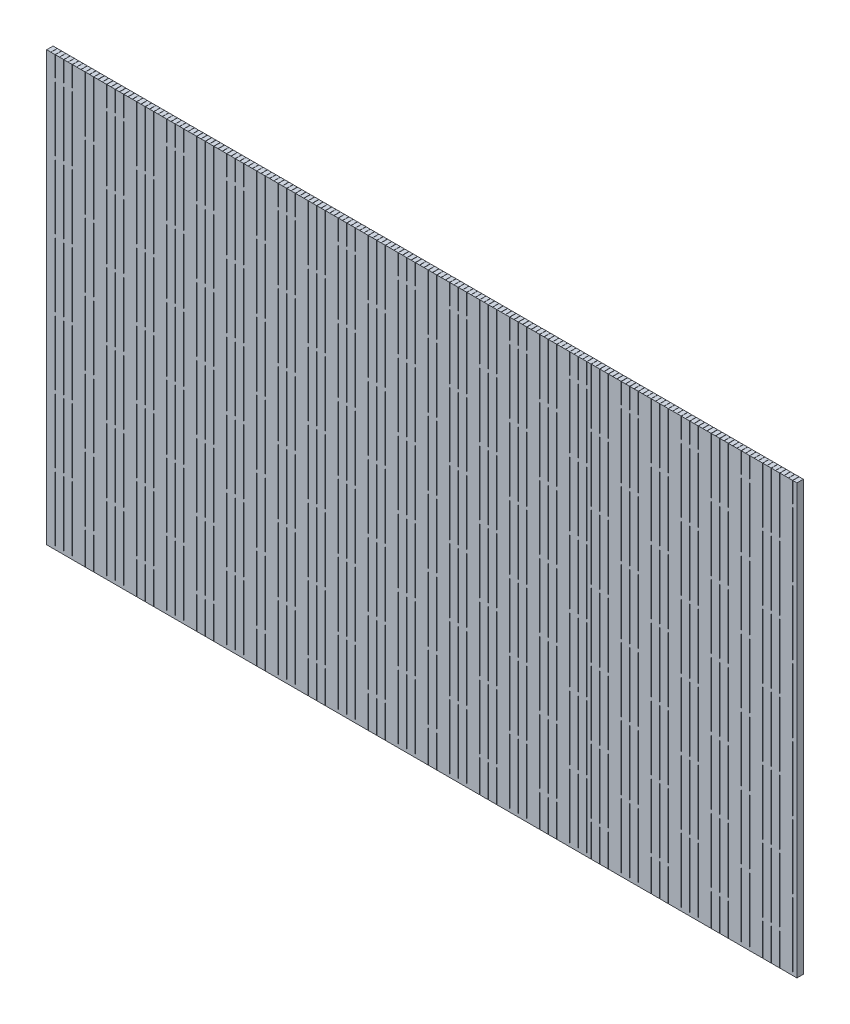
SolidWorks part; units mm, degrees
ref_plane "Front Plane" through (0, 0, 0) normal (0, 0, 1) x (1, 0, 0)
ref_plane "Top Plane" through (0, 0, 0) normal (0, 1, 0) x (1, 0, 0)
ref_plane "Right Plane" through (0, 0, 0) normal (1, 0, 0) x (0, 0, -1)
sketch "Sketch1" plane through (0, 0, 0) normal (0, 0, 1) x (1, 0, 0)
  line L1 (0, 0) -> (-350, 0)
  line L2 (0, 0) -> (0, 200)
  line L3 (0, 200) -> (-350, 200)
  line L4 (-350, 0) -> (-350, 200)
extrude "Boss-Extrude1" add sketch "Sketch1" along normal blind 3
sketch "Sketch3" plane through (0, 0, 0) normal (0, 0, -1) x (-1, 0, 0)
  line L0 (2, 1.5) -> (2, 31.5)
  line L1 (0, 0) -> (0, 200) construction
  line L2 (350, 0) -> (0, 0) construction
  line L3 (4, 15) -> (4, -15)
  line L4 (6, 1.5) -> (6, 31.5)
  line L5 (8, 15) -> (8, -15)
  line L6 (10, 1.5) -> (10, 31.5)
  line L7 (12, 15) -> (12, -15)
  line L8 (14, 1.5) -> (14, 31.5)
  line L9 (16, 15) -> (16, -15)
  line L10 (18, 1.5) -> (18, 31.5)
  line L11 (20, 15) -> (20, -15)
  line L12 (22, 1.5) -> (22, 31.5)
  line L13 (24, 15) -> (24, -15)
  line L14 (26, 1.5) -> (26, 31.5)
  line L15 (28, 15) -> (28, -15)
  line L16 (30, 1.5) -> (30, 31.5)
  line L17 (32, 15) -> (32, -15)
  line L18 (34, 1.5) -> (34, 31.5)
  line L19 (36, 15) -> (36, -15)
  line L20 (38, 1.5) -> (38, 31.5)
  line L21 (40, 15) -> (40, -15)
  line L22 (42, 1.5) -> (42, 31.5)
  line L23 (44, 15) -> (44, -15)
  line L24 (46, 1.5) -> (46, 31.5)
  line L25 (48, 15) -> (48, -15)
  line L26 (50, 1.5) -> (50, 31.5)
  line L27 (52, 15) -> (52, -15)
  line L28 (54, 1.5) -> (54, 31.5)
  line L29 (56, 15) -> (56, -15)
  line L30 (58, 1.5) -> (58, 31.5)
  line L31 (60, 15) -> (60, -15)
  line L32 (62, 1.5) -> (62, 31.5)
  line L33 (64, 15) -> (64, -15)
  line L34 (66, 1.5) -> (66, 31.5)
  line L35 (68, 15) -> (68, -15)
  line L36 (70, 1.5) -> (70, 31.5)
  line L37 (72, 15) -> (72, -15)
  line L38 (74, 1.5) -> (74, 31.5)
  line L39 (76, 15) -> (76, -15)
  line L40 (78, 1.5) -> (78, 31.5)
  line L41 (80, 15) -> (80, -15)
  line L42 (82, 1.5) -> (82, 31.5)
  line L43 (84, 15) -> (84, -15)
  line L44 (86, 1.5) -> (86, 31.5)
  line L45 (88, 15) -> (88, -15)
  line L46 (90, 1.5) -> (90, 31.5)
  line L47 (92, 15) -> (92, -15)
  line L48 (94, 1.5) -> (94, 31.5)
  line L49 (96, 15) -> (96, -15)
  line L50 (98, 1.5) -> (98, 31.5)
  line L51 (100, 15) -> (100, -15)
  line L52 (102, 1.5) -> (102, 31.5)
  line L53 (104, 15) -> (104, -15)
  line L54 (106, 1.5) -> (106, 31.5)
  line L55 (108, 15) -> (108, -15)
  line L56 (110, 1.5) -> (110, 31.5)
  line L57 (112, 15) -> (112, -15)
  line L58 (114, 1.5) -> (114, 31.5)
  line L59 (116, 15) -> (116, -15)
  line L60 (118, 1.5) -> (118, 31.5)
  line L61 (120, 15) -> (120, -15)
  line L62 (122, 1.5) -> (122, 31.5)
  line L63 (124, 15) -> (124, -15)
  line L64 (126, 1.5) -> (126, 31.5)
  line L65 (128, 15) -> (128, -15)
  line L66 (130, 1.5) -> (130, 31.5)
  line L67 (132, 15) -> (132, -15)
  line L68 (134, 1.5) -> (134, 31.5)
  line L69 (136, 15) -> (136, -15)
  line L70 (138, 1.5) -> (138, 31.5)
  line L71 (140, 15) -> (140, -15)
  line L72 (142, 1.5) -> (142, 31.5)
  line L73 (144, 15) -> (144, -15)
  line L74 (146, 1.5) -> (146, 31.5)
  line L75 (148, 15) -> (148, -15)
  line L76 (150, 1.5) -> (150, 31.5)
  line L77 (152, 15) -> (152, -15)
  line L78 (154, 1.5) -> (154, 31.5)
  line L79 (156, 15) -> (156, -15)
  line L80 (158, 1.5) -> (158, 31.5)
  line L81 (160, 15) -> (160, -15)
  line L82 (162, 1.5) -> (162, 31.5)
  line L83 (164, 15) -> (164, -15)
  line L84 (166, 1.5) -> (166, 31.5)
  line L85 (168, 15) -> (168, -15)
  line L86 (170, 1.5) -> (170, 31.5)
  line L87 (172, 15) -> (172, -15)
  line L88 (174, 1.5) -> (174, 31.5)
  line L89 (176, 15) -> (176, -15)
  line L90 (178, 1.5) -> (178, 31.5)
  line L91 (180, 15) -> (180, -15)
  line L92 (182, 1.5) -> (182, 31.5)
  line L93 (184, 15) -> (184, -15)
  line L94 (186, 1.5) -> (186, 31.5)
  line L95 (188, 15) -> (188, -15)
  line L96 (190, 1.5) -> (190, 31.5)
  line L97 (192, 15) -> (192, -15)
  line L98 (194, 1.5) -> (194, 31.5)
  line L99 (196, 15) -> (196, -15)
  line L100 (198, 1.5) -> (198, 31.5)
  line L101 (200, 15) -> (200, -15)
  line L102 (202, 1.5) -> (202, 31.5)
  line L103 (204, 15) -> (204, -15)
  line L104 (206, 1.5) -> (206, 31.5)
  line L105 (208, 15) -> (208, -15)
  line L106 (210, 1.5) -> (210, 31.5)
  line L107 (212, 15) -> (212, -15)
  line L108 (214, 1.5) -> (214, 31.5)
  line L109 (216, 15) -> (216, -15)
  line L110 (218, 1.5) -> (218, 31.5)
  line L111 (220, 15) -> (220, -15)
  line L112 (222, 1.5) -> (222, 31.5)
  line L113 (224, 15) -> (224, -15)
  line L114 (226, 1.5) -> (226, 31.5)
  line L115 (228, 15) -> (228, -15)
  line L116 (230, 1.5) -> (230, 31.5)
  line L117 (232, 15) -> (232, -15)
  line L118 (234, 1.5) -> (234, 31.5)
  line L119 (236, 15) -> (236, -15)
  line L120 (238, 1.5) -> (238, 31.5)
  line L121 (240, 15) -> (240, -15)
  line L122 (242, 1.5) -> (242, 31.5)
  line L123 (244, 15) -> (244, -15)
  line L124 (246, 1.5) -> (246, 31.5)
  line L125 (248, 15) -> (248, -15)
  line L126 (250, 1.5) -> (250, 31.5)
  line L127 (252, 15) -> (252, -15)
  line L128 (254, 1.5) -> (254, 31.5)
  line L129 (256, 15) -> (256, -15)
  line L130 (258, 1.5) -> (258, 31.5)
  line L131 (260, 15) -> (260, -15)
  line L132 (262, 1.5) -> (262, 31.5)
  line L133 (264, 15) -> (264, -15)
  line L134 (266, 1.5) -> (266, 31.5)
  line L135 (268, 15) -> (268, -15)
  line L136 (270, 1.5) -> (270, 31.5)
  line L137 (272, 15) -> (272, -15)
  line L138 (274, 1.5) -> (274, 31.5)
  line L139 (276, 15) -> (276, -15)
  line L140 (278, 1.5) -> (278, 31.5)
  line L141 (280, 15) -> (280, -15)
  line L142 (282, 1.5) -> (282, 31.5)
  line L143 (284, 15) -> (284, -15)
  line L144 (286, 1.5) -> (286, 31.5)
  line L145 (288, 15) -> (288, -15)
  line L146 (290, 1.5) -> (290, 31.5)
  line L147 (292, 15) -> (292, -15)
  line L148 (294, 1.5) -> (294, 31.5)
  line L149 (296, 15) -> (296, -15)
  line L150 (298, 1.5) -> (298, 31.5)
  line L151 (300, 15) -> (300, -15)
  line L152 (302, 1.5) -> (302, 31.5)
  line L153 (304, 15) -> (304, -15)
  line L154 (306, 1.5) -> (306, 31.5)
  line L155 (308, 15) -> (308, -15)
  line L156 (310, 1.5) -> (310, 31.5)
  line L157 (312, 15) -> (312, -15)
  line L158 (314, 1.5) -> (314, 31.5)
  line L159 (316, 15) -> (316, -15)
  line L160 (318, 1.5) -> (318, 31.5)
  line L161 (320, 15) -> (320, -15)
  line L162 (322, 1.5) -> (322, 31.5)
  line L163 (324, 15) -> (324, -15)
  line L164 (326, 1.5) -> (326, 31.5)
  line L165 (328, 15) -> (328, -15)
  line L166 (330, 1.5) -> (330, 31.5)
  line L167 (332, 15) -> (332, -15)
  line L168 (334, 1.5) -> (334, 31.5)
  line L169 (336, 15) -> (336, -15)
  line L170 (338, 1.5) -> (338, 31.5)
  line L171 (340, 15) -> (340, -15)
  line L172 (342, 1.5) -> (342, 31.5)
  line L173 (344, 15) -> (344, -15)
  line L174 (346, 1.5) -> (346, 31.5)
  line L175 (348, 15) -> (348, -15)
  line L176 (6, 33) -> (6, 63)
  line L177 (8, 46.5) -> (8, 16.5)
  line L178 (10, 33) -> (10, 63)
  line L179 (12, 46.5) -> (12, 16.5)
  line L180 (14, 33) -> (14, 63)
  line L181 (16, 46.5) -> (16, 16.5)
  line L182 (18, 33) -> (18, 63)
  line L183 (20, 46.5) -> (20, 16.5)
  line L184 (22, 33) -> (22, 63)
  line L185 (24, 46.5) -> (24, 16.5)
  line L186 (26, 33) -> (26, 63)
  line L187 (28, 46.5) -> (28, 16.5)
  line L188 (30, 33) -> (30, 63)
  line L189 (32, 46.5) -> (32, 16.5)
  line L190 (34, 33) -> (34, 63)
  line L191 (36, 46.5) -> (36, 16.5)
  line L192 (38, 33) -> (38, 63)
  line L193 (40, 46.5) -> (40, 16.5)
  line L194 (42, 33) -> (42, 63)
  line L195 (44, 46.5) -> (44, 16.5)
  line L196 (46, 33) -> (46, 63)
  line L197 (48, 46.5) -> (48, 16.5)
  line L198 (50, 33) -> (50, 63)
  line L199 (52, 46.5) -> (52, 16.5)
  line L200 (54, 33) -> (54, 63)
  line L201 (56, 46.5) -> (56, 16.5)
  line L202 (58, 33) -> (58, 63)
  line L203 (60, 46.5) -> (60, 16.5)
  line L204 (62, 33) -> (62, 63)
  line L205 (64, 46.5) -> (64, 16.5)
  line L206 (66, 33) -> (66, 63)
  line L207 (68, 46.5) -> (68, 16.5)
  line L208 (70, 33) -> (70, 63)
  line L209 (72, 46.5) -> (72, 16.5)
  line L210 (74, 33) -> (74, 63)
  line L211 (76, 46.5) -> (76, 16.5)
  line L212 (78, 33) -> (78, 63)
  line L213 (80, 46.5) -> (80, 16.5)
  line L214 (82, 33) -> (82, 63)
  line L215 (84, 46.5) -> (84, 16.5)
  line L216 (86, 33) -> (86, 63)
  line L217 (88, 46.5) -> (88, 16.5)
  line L218 (90, 33) -> (90, 63)
  line L219 (92, 46.5) -> (92, 16.5)
  line L220 (94, 33) -> (94, 63)
  line L221 (96, 46.5) -> (96, 16.5)
  line L222 (98, 33) -> (98, 63)
  line L223 (100, 46.5) -> (100, 16.5)
  line L224 (102, 33) -> (102, 63)
  line L225 (104, 46.5) -> (104, 16.5)
  line L226 (106, 33) -> (106, 63)
  line L227 (108, 46.5) -> (108, 16.5)
  line L228 (110, 33) -> (110, 63)
  line L229 (112, 46.5) -> (112, 16.5)
  line L230 (114, 33) -> (114, 63)
  line L231 (116, 46.5) -> (116, 16.5)
  line L232 (118, 33) -> (118, 63)
  line L233 (120, 46.5) -> (120, 16.5)
  line L234 (122, 33) -> (122, 63)
  line L235 (124, 46.5) -> (124, 16.5)
  line L236 (126, 33) -> (126, 63)
  line L237 (128, 46.5) -> (128, 16.5)
  line L238 (130, 33) -> (130, 63)
  line L239 (132, 46.5) -> (132, 16.5)
  line L240 (134, 33) -> (134, 63)
  line L241 (136, 46.5) -> (136, 16.5)
  line L242 (138, 33) -> (138, 63)
  line L243 (140, 46.5) -> (140, 16.5)
  line L244 (142, 33) -> (142, 63)
  line L245 (144, 46.5) -> (144, 16.5)
  line L246 (146, 33) -> (146, 63)
  line L247 (148, 46.5) -> (148, 16.5)
  line L248 (150, 33) -> (150, 63)
  line L249 (152, 46.5) -> (152, 16.5)
  line L250 (154, 33) -> (154, 63)
  line L251 (156, 46.5) -> (156, 16.5)
  line L252 (158, 33) -> (158, 63)
  line L253 (160, 46.5) -> (160, 16.5)
  line L254 (162, 33) -> (162, 63)
  line L255 (164, 46.5) -> (164, 16.5)
  line L256 (166, 33) -> (166, 63)
  line L257 (168, 46.5) -> (168, 16.5)
  line L258 (170, 33) -> (170, 63)
  line L259 (172, 46.5) -> (172, 16.5)
  line L260 (174, 33) -> (174, 63)
  line L261 (176, 46.5) -> (176, 16.5)
  line L262 (178, 33) -> (178, 63)
  line L263 (180, 46.5) -> (180, 16.5)
  line L264 (182, 33) -> (182, 63)
  line L265 (184, 46.5) -> (184, 16.5)
  line L266 (186, 33) -> (186, 63)
  line L267 (188, 46.5) -> (188, 16.5)
  line L268 (190, 33) -> (190, 63)
  line L269 (192, 46.5) -> (192, 16.5)
  line L270 (194, 33) -> (194, 63)
  line L271 (196, 46.5) -> (196, 16.5)
  line L272 (198, 33) -> (198, 63)
  line L273 (200, 46.5) -> (200, 16.5)
  line L274 (202, 33) -> (202, 63)
  line L275 (204, 46.5) -> (204, 16.5)
  line L276 (206, 33) -> (206, 63)
  line L277 (208, 46.5) -> (208, 16.5)
  line L278 (210, 33) -> (210, 63)
  line L279 (212, 46.5) -> (212, 16.5)
  line L280 (214, 33) -> (214, 63)
  line L281 (216, 46.5) -> (216, 16.5)
  line L282 (218, 33) -> (218, 63)
  line L283 (220, 46.5) -> (220, 16.5)
  line L284 (222, 33) -> (222, 63)
  line L285 (224, 46.5) -> (224, 16.5)
  line L286 (226, 33) -> (226, 63)
  line L287 (228, 46.5) -> (228, 16.5)
  line L288 (230, 33) -> (230, 63)
  line L289 (232, 46.5) -> (232, 16.5)
  line L290 (234, 33) -> (234, 63)
  line L291 (236, 46.5) -> (236, 16.5)
  line L292 (238, 33) -> (238, 63)
  line L293 (240, 46.5) -> (240, 16.5)
  line L294 (242, 33) -> (242, 63)
  line L295 (244, 46.5) -> (244, 16.5)
  line L296 (246, 33) -> (246, 63)
  line L297 (248, 46.5) -> (248, 16.5)
  line L298 (250, 33) -> (250, 63)
  line L299 (252, 46.5) -> (252, 16.5)
  line L300 (254, 33) -> (254, 63)
  line L301 (256, 46.5) -> (256, 16.5)
  line L302 (258, 33) -> (258, 63)
  line L303 (260, 46.5) -> (260, 16.5)
  line L304 (262, 33) -> (262, 63)
  line L305 (264, 46.5) -> (264, 16.5)
  line L306 (266, 33) -> (266, 63)
  line L307 (268, 46.5) -> (268, 16.5)
  line L308 (270, 33) -> (270, 63)
  line L309 (272, 46.5) -> (272, 16.5)
  line L310 (274, 33) -> (274, 63)
  line L311 (276, 46.5) -> (276, 16.5)
  line L312 (278, 33) -> (278, 63)
  line L313 (280, 46.5) -> (280, 16.5)
  line L314 (282, 33) -> (282, 63)
  line L315 (284, 46.5) -> (284, 16.5)
  line L316 (286, 33) -> (286, 63)
  line L317 (288, 46.5) -> (288, 16.5)
  line L318 (290, 33) -> (290, 63)
  line L319 (292, 46.5) -> (292, 16.5)
  line L320 (294, 33) -> (294, 63)
  line L321 (296, 46.5) -> (296, 16.5)
  line L322 (298, 33) -> (298, 63)
  line L323 (300, 46.5) -> (300, 16.5)
  line L324 (302, 33) -> (302, 63)
  line L325 (304, 46.5) -> (304, 16.5)
  line L326 (306, 33) -> (306, 63)
  line L327 (308, 46.5) -> (308, 16.5)
  line L328 (310, 33) -> (310, 63)
  line L329 (312, 46.5) -> (312, 16.5)
  line L330 (314, 33) -> (314, 63)
  line L331 (316, 46.5) -> (316, 16.5)
  line L332 (318, 33) -> (318, 63)
  line L333 (320, 46.5) -> (320, 16.5)
  line L334 (322, 33) -> (322, 63)
  line L335 (324, 46.5) -> (324, 16.5)
  line L336 (326, 33) -> (326, 63)
  line L337 (328, 46.5) -> (328, 16.5)
  line L338 (330, 33) -> (330, 63)
  line L339 (332, 46.5) -> (332, 16.5)
  line L340 (334, 33) -> (334, 63)
  line L341 (336, 46.5) -> (336, 16.5)
  line L342 (338, 33) -> (338, 63)
  line L343 (340, 46.5) -> (340, 16.5)
  line L344 (342, 33) -> (342, 63)
  line L345 (344, 46.5) -> (344, 16.5)
  line L346 (346, 33) -> (346, 63)
  line L347 (348, 46.5) -> (348, 16.5)
  line L348 (6, 64.5) -> (6, 94.5)
  line L349 (8, 78) -> (8, 48)
  line L350 (10, 64.5) -> (10, 94.5)
  line L351 (12, 78) -> (12, 48)
  line L352 (14, 64.5) -> (14, 94.5)
  line L353 (16, 78) -> (16, 48)
  line L354 (18, 64.5) -> (18, 94.5)
  line L355 (20, 78) -> (20, 48)
  line L356 (22, 64.5) -> (22, 94.5)
  line L357 (24, 78) -> (24, 48)
  line L358 (26, 64.5) -> (26, 94.5)
  line L359 (28, 78) -> (28, 48)
  line L360 (30, 64.5) -> (30, 94.5)
  line L361 (32, 78) -> (32, 48)
  line L362 (34, 64.5) -> (34, 94.5)
  line L363 (36, 78) -> (36, 48)
  line L364 (38, 64.5) -> (38, 94.5)
  line L365 (40, 78) -> (40, 48)
  line L366 (42, 64.5) -> (42, 94.5)
  line L367 (44, 78) -> (44, 48)
  line L368 (46, 64.5) -> (46, 94.5)
  line L369 (48, 78) -> (48, 48)
  line L370 (50, 64.5) -> (50, 94.5)
  line L371 (52, 78) -> (52, 48)
  line L372 (54, 64.5) -> (54, 94.5)
  line L373 (56, 78) -> (56, 48)
  line L374 (58, 64.5) -> (58, 94.5)
  line L375 (60, 78) -> (60, 48)
  line L376 (62, 64.5) -> (62, 94.5)
  line L377 (64, 78) -> (64, 48)
  line L378 (66, 64.5) -> (66, 94.5)
  line L379 (68, 78) -> (68, 48)
  line L380 (70, 64.5) -> (70, 94.5)
  line L381 (72, 78) -> (72, 48)
  line L382 (74, 64.5) -> (74, 94.5)
  line L383 (76, 78) -> (76, 48)
  line L384 (78, 64.5) -> (78, 94.5)
  line L385 (80, 78) -> (80, 48)
  line L386 (82, 64.5) -> (82, 94.5)
  line L387 (84, 78) -> (84, 48)
  line L388 (86, 64.5) -> (86, 94.5)
  line L389 (88, 78) -> (88, 48)
  line L390 (90, 64.5) -> (90, 94.5)
  line L391 (92, 78) -> (92, 48)
  line L392 (94, 64.5) -> (94, 94.5)
  line L393 (96, 78) -> (96, 48)
  line L394 (98, 64.5) -> (98, 94.5)
  line L395 (100, 78) -> (100, 48)
  line L396 (102, 64.5) -> (102, 94.5)
  line L397 (104, 78) -> (104, 48)
  line L398 (106, 64.5) -> (106, 94.5)
  line L399 (108, 78) -> (108, 48)
  line L400 (110, 64.5) -> (110, 94.5)
  line L401 (112, 78) -> (112, 48)
  line L402 (114, 64.5) -> (114, 94.5)
  line L403 (116, 78) -> (116, 48)
  line L404 (118, 64.5) -> (118, 94.5)
  line L405 (120, 78) -> (120, 48)
  line L406 (122, 64.5) -> (122, 94.5)
  line L407 (124, 78) -> (124, 48)
  line L408 (126, 64.5) -> (126, 94.5)
  line L409 (128, 78) -> (128, 48)
  line L410 (130, 64.5) -> (130, 94.5)
  line L411 (132, 78) -> (132, 48)
  line L412 (134, 64.5) -> (134, 94.5)
  line L413 (136, 78) -> (136, 48)
  line L414 (138, 64.5) -> (138, 94.5)
  line L415 (140, 78) -> (140, 48)
  line L416 (142, 64.5) -> (142, 94.5)
  line L417 (144, 78) -> (144, 48)
  line L418 (146, 64.5) -> (146, 94.5)
  line L419 (148, 78) -> (148, 48)
  line L420 (150, 64.5) -> (150, 94.5)
  line L421 (152, 78) -> (152, 48)
  line L422 (154, 64.5) -> (154, 94.5)
  line L423 (156, 78) -> (156, 48)
  line L424 (158, 64.5) -> (158, 94.5)
  line L425 (160, 78) -> (160, 48)
  line L426 (162, 64.5) -> (162, 94.5)
  line L427 (164, 78) -> (164, 48)
  line L428 (166, 64.5) -> (166, 94.5)
  line L429 (168, 78) -> (168, 48)
  line L430 (170, 64.5) -> (170, 94.5)
  line L431 (172, 78) -> (172, 48)
  line L432 (174, 64.5) -> (174, 94.5)
  line L433 (176, 78) -> (176, 48)
  line L434 (178, 64.5) -> (178, 94.5)
  line L435 (180, 78) -> (180, 48)
  line L436 (182, 64.5) -> (182, 94.5)
  line L437 (184, 78) -> (184, 48)
  line L438 (186, 64.5) -> (186, 94.5)
  line L439 (188, 78) -> (188, 48)
  line L440 (190, 64.5) -> (190, 94.5)
  line L441 (192, 78) -> (192, 48)
  line L442 (194, 64.5) -> (194, 94.5)
  line L443 (196, 78) -> (196, 48)
  line L444 (198, 64.5) -> (198, 94.5)
  line L445 (200, 78) -> (200, 48)
  line L446 (202, 64.5) -> (202, 94.5)
  line L447 (204, 78) -> (204, 48)
  line L448 (206, 64.5) -> (206, 94.5)
  line L449 (208, 78) -> (208, 48)
  line L450 (210, 64.5) -> (210, 94.5)
  line L451 (212, 78) -> (212, 48)
  line L452 (214, 64.5) -> (214, 94.5)
  line L453 (216, 78) -> (216, 48)
  line L454 (218, 64.5) -> (218, 94.5)
  line L455 (220, 78) -> (220, 48)
  line L456 (222, 64.5) -> (222, 94.5)
  line L457 (224, 78) -> (224, 48)
  line L458 (226, 64.5) -> (226, 94.5)
  line L459 (228, 78) -> (228, 48)
  line L460 (230, 64.5) -> (230, 94.5)
  line L461 (232, 78) -> (232, 48)
  line L462 (234, 64.5) -> (234, 94.5)
  line L463 (236, 78) -> (236, 48)
  line L464 (238, 64.5) -> (238, 94.5)
  line L465 (240, 78) -> (240, 48)
  line L466 (242, 64.5) -> (242, 94.5)
  line L467 (244, 78) -> (244, 48)
  line L468 (246, 64.5) -> (246, 94.5)
  line L469 (248, 78) -> (248, 48)
  line L470 (250, 64.5) -> (250, 94.5)
  line L471 (252, 78) -> (252, 48)
  line L472 (254, 64.5) -> (254, 94.5)
  line L473 (256, 78) -> (256, 48)
  line L474 (258, 64.5) -> (258, 94.5)
  line L475 (260, 78) -> (260, 48)
  line L476 (262, 64.5) -> (262, 94.5)
  line L477 (264, 78) -> (264, 48)
  line L478 (266, 64.5) -> (266, 94.5)
  line L479 (268, 78) -> (268, 48)
  line L480 (270, 64.5) -> (270, 94.5)
  line L481 (272, 78) -> (272, 48)
  line L482 (274, 64.5) -> (274, 94.5)
  line L483 (276, 78) -> (276, 48)
  line L484 (278, 64.5) -> (278, 94.5)
  line L485 (280, 78) -> (280, 48)
  line L486 (282, 64.5) -> (282, 94.5)
  line L487 (284, 78) -> (284, 48)
  line L488 (286, 64.5) -> (286, 94.5)
  line L489 (288, 78) -> (288, 48)
  line L490 (290, 64.5) -> (290, 94.5)
  line L491 (292, 78) -> (292, 48)
  line L492 (294, 64.5) -> (294, 94.5)
  line L493 (296, 78) -> (296, 48)
  line L494 (298, 64.5) -> (298, 94.5)
  line L495 (300, 78) -> (300, 48)
  line L496 (302, 64.5) -> (302, 94.5)
  line L497 (304, 78) -> (304, 48)
  line L498 (306, 64.5) -> (306, 94.5)
  line L499 (308, 78) -> (308, 48)
  line L500 (310, 64.5) -> (310, 94.5)
  line L501 (312, 78) -> (312, 48)
  line L502 (314, 64.5) -> (314, 94.5)
  line L503 (316, 78) -> (316, 48)
  line L504 (318, 64.5) -> (318, 94.5)
  line L505 (320, 78) -> (320, 48)
  line L506 (322, 64.5) -> (322, 94.5)
  line L507 (324, 78) -> (324, 48)
  line L508 (326, 64.5) -> (326, 94.5)
  line L509 (328, 78) -> (328, 48)
  line L510 (330, 64.5) -> (330, 94.5)
  line L511 (332, 78) -> (332, 48)
  line L512 (334, 64.5) -> (334, 94.5)
  line L513 (336, 78) -> (336, 48)
  line L514 (338, 64.5) -> (338, 94.5)
  line L515 (340, 78) -> (340, 48)
  line L516 (342, 64.5) -> (342, 94.5)
  line L517 (344, 78) -> (344, 48)
  line L518 (346, 64.5) -> (346, 94.5)
  line L519 (348, 78) -> (348, 48)
  line L520 (6, 96) -> (6, 126)
  line L521 (8, 109.5) -> (8, 79.5)
  line L522 (10, 96) -> (10, 126)
  line L523 (12, 109.5) -> (12, 79.5)
  line L524 (14, 96) -> (14, 126)
  line L525 (16, 109.5) -> (16, 79.5)
  line L526 (18, 96) -> (18, 126)
  line L527 (20, 109.5) -> (20, 79.5)
  line L528 (22, 96) -> (22, 126)
  line L529 (24, 109.5) -> (24, 79.5)
  line L530 (26, 96) -> (26, 126)
  line L531 (28, 109.5) -> (28, 79.5)
  line L532 (30, 96) -> (30, 126)
  line L533 (32, 109.5) -> (32, 79.5)
  line L534 (34, 96) -> (34, 126)
  line L535 (36, 109.5) -> (36, 79.5)
  line L536 (38, 96) -> (38, 126)
  line L537 (40, 109.5) -> (40, 79.5)
  line L538 (42, 96) -> (42, 126)
  line L539 (44, 109.5) -> (44, 79.5)
  line L540 (46, 96) -> (46, 126)
  line L541 (48, 109.5) -> (48, 79.5)
  line L542 (50, 96) -> (50, 126)
  line L543 (52, 109.5) -> (52, 79.5)
  line L544 (54, 96) -> (54, 126)
  line L545 (56, 109.5) -> (56, 79.5)
  line L546 (58, 96) -> (58, 126)
  line L547 (60, 109.5) -> (60, 79.5)
  line L548 (62, 96) -> (62, 126)
  line L549 (64, 109.5) -> (64, 79.5)
  line L550 (66, 96) -> (66, 126)
  line L551 (68, 109.5) -> (68, 79.5)
  line L552 (70, 96) -> (70, 126)
  line L553 (72, 109.5) -> (72, 79.5)
  line L554 (74, 96) -> (74, 126)
  line L555 (76, 109.5) -> (76, 79.5)
  line L556 (78, 96) -> (78, 126)
  line L557 (80, 109.5) -> (80, 79.5)
  line L558 (82, 96) -> (82, 126)
  line L559 (84, 109.5) -> (84, 79.5)
  line L560 (86, 96) -> (86, 126)
  line L561 (88, 109.5) -> (88, 79.5)
  line L562 (90, 96) -> (90, 126)
  line L563 (92, 109.5) -> (92, 79.5)
  line L564 (94, 96) -> (94, 126)
  line L565 (96, 109.5) -> (96, 79.5)
  line L566 (98, 96) -> (98, 126)
  line L567 (100, 109.5) -> (100, 79.5)
  line L568 (102, 96) -> (102, 126)
  line L569 (104, 109.5) -> (104, 79.5)
  line L570 (106, 96) -> (106, 126)
  line L571 (108, 109.5) -> (108, 79.5)
  line L572 (110, 96) -> (110, 126)
  line L573 (112, 109.5) -> (112, 79.5)
  line L574 (114, 96) -> (114, 126)
  line L575 (116, 109.5) -> (116, 79.5)
  line L576 (118, 96) -> (118, 126)
  line L577 (120, 109.5) -> (120, 79.5)
  line L578 (122, 96) -> (122, 126)
  line L579 (124, 109.5) -> (124, 79.5)
  line L580 (126, 96) -> (126, 126)
  line L581 (128, 109.5) -> (128, 79.5)
  line L582 (130, 96) -> (130, 126)
  line L583 (132, 109.5) -> (132, 79.5)
  line L584 (134, 96) -> (134, 126)
  line L585 (136, 109.5) -> (136, 79.5)
  line L586 (138, 96) -> (138, 126)
  line L587 (140, 109.5) -> (140, 79.5)
  line L588 (142, 96) -> (142, 126)
  line L589 (144, 109.5) -> (144, 79.5)
  line L590 (146, 96) -> (146, 126)
  line L591 (148, 109.5) -> (148, 79.5)
  line L592 (150, 96) -> (150, 126)
  line L593 (152, 109.5) -> (152, 79.5)
  line L594 (154, 96) -> (154, 126)
  line L595 (156, 109.5) -> (156, 79.5)
  line L596 (158, 96) -> (158, 126)
  line L597 (160, 109.5) -> (160, 79.5)
  line L598 (162, 96) -> (162, 126)
  line L599 (164, 109.5) -> (164, 79.5)
  line L600 (166, 96) -> (166, 126)
  line L601 (168, 109.5) -> (168, 79.5)
  line L602 (170, 96) -> (170, 126)
  line L603 (172, 109.5) -> (172, 79.5)
  line L604 (174, 96) -> (174, 126)
  line L605 (176, 109.5) -> (176, 79.5)
  line L606 (178, 96) -> (178, 126)
  line L607 (180, 109.5) -> (180, 79.5)
  line L608 (182, 96) -> (182, 126)
  line L609 (184, 109.5) -> (184, 79.5)
  line L610 (186, 96) -> (186, 126)
  line L611 (188, 109.5) -> (188, 79.5)
  line L612 (190, 96) -> (190, 126)
  line L613 (192, 109.5) -> (192, 79.5)
  line L614 (194, 96) -> (194, 126)
  line L615 (196, 109.5) -> (196, 79.5)
  line L616 (198, 96) -> (198, 126)
  line L617 (200, 109.5) -> (200, 79.5)
  line L618 (202, 96) -> (202, 126)
  line L619 (204, 109.5) -> (204, 79.5)
  line L620 (206, 96) -> (206, 126)
  line L621 (208, 109.5) -> (208, 79.5)
  line L622 (210, 96) -> (210, 126)
  line L623 (212, 109.5) -> (212, 79.5)
  line L624 (214, 96) -> (214, 126)
  line L625 (216, 109.5) -> (216, 79.5)
  line L626 (218, 96) -> (218, 126)
  line L627 (220, 109.5) -> (220, 79.5)
  line L628 (222, 96) -> (222, 126)
  line L629 (224, 109.5) -> (224, 79.5)
  line L630 (226, 96) -> (226, 126)
  line L631 (228, 109.5) -> (228, 79.5)
  line L632 (230, 96) -> (230, 126)
  line L633 (232, 109.5) -> (232, 79.5)
  line L634 (234, 96) -> (234, 126)
  line L635 (236, 109.5) -> (236, 79.5)
  line L636 (238, 96) -> (238, 126)
  line L637 (240, 109.5) -> (240, 79.5)
  line L638 (242, 96) -> (242, 126)
  line L639 (244, 109.5) -> (244, 79.5)
  line L640 (246, 96) -> (246, 126)
  line L641 (248, 109.5) -> (248, 79.5)
  line L642 (250, 96) -> (250, 126)
  line L643 (252, 109.5) -> (252, 79.5)
  line L644 (254, 96) -> (254, 126)
  line L645 (256, 109.5) -> (256, 79.5)
  line L646 (258, 96) -> (258, 126)
  line L647 (260, 109.5) -> (260, 79.5)
  line L648 (262, 96) -> (262, 126)
  line L649 (264, 109.5) -> (264, 79.5)
  line L650 (266, 96) -> (266, 126)
  line L651 (268, 109.5) -> (268, 79.5)
  line L652 (270, 96) -> (270, 126)
  line L653 (272, 109.5) -> (272, 79.5)
  line L654 (274, 96) -> (274, 126)
  line L655 (276, 109.5) -> (276, 79.5)
  line L656 (278, 96) -> (278, 126)
  line L657 (280, 109.5) -> (280, 79.5)
  line L658 (282, 96) -> (282, 126)
  line L659 (284, 109.5) -> (284, 79.5)
  line L660 (286, 96) -> (286, 126)
  line L661 (288, 109.5) -> (288, 79.5)
  line L662 (290, 96) -> (290, 126)
  line L663 (292, 109.5) -> (292, 79.5)
  line L664 (294, 96) -> (294, 126)
  line L665 (296, 109.5) -> (296, 79.5)
  line L666 (298, 96) -> (298, 126)
  line L667 (300, 109.5) -> (300, 79.5)
  line L668 (302, 96) -> (302, 126)
  line L669 (304, 109.5) -> (304, 79.5)
  line L670 (306, 96) -> (306, 126)
  line L671 (308, 109.5) -> (308, 79.5)
  line L672 (310, 96) -> (310, 126)
  line L673 (312, 109.5) -> (312, 79.5)
  line L674 (314, 96) -> (314, 126)
  line L675 (316, 109.5) -> (316, 79.5)
  line L676 (318, 96) -> (318, 126)
  line L677 (320, 109.5) -> (320, 79.5)
  line L678 (322, 96) -> (322, 126)
  line L679 (324, 109.5) -> (324, 79.5)
  line L680 (326, 96) -> (326, 126)
  line L681 (328, 109.5) -> (328, 79.5)
  line L682 (330, 96) -> (330, 126)
  line L683 (332, 109.5) -> (332, 79.5)
  line L684 (334, 96) -> (334, 126)
  line L685 (336, 109.5) -> (336, 79.5)
  line L686 (338, 96) -> (338, 126)
  line L687 (340, 109.5) -> (340, 79.5)
  line L688 (342, 96) -> (342, 126)
  line L689 (344, 109.5) -> (344, 79.5)
  line L690 (346, 96) -> (346, 126)
  line L691 (348, 109.5) -> (348, 79.5)
  line L692 (6, 127.5) -> (6, 157.5)
  line L693 (8, 141) -> (8, 111)
  line L694 (10, 127.5) -> (10, 157.5)
  line L695 (12, 141) -> (12, 111)
  line L696 (14, 127.5) -> (14, 157.5)
  line L697 (16, 141) -> (16, 111)
  line L698 (18, 127.5) -> (18, 157.5)
  line L699 (20, 141) -> (20, 111)
  line L700 (22, 127.5) -> (22, 157.5)
  line L701 (24, 141) -> (24, 111)
  line L702 (26, 127.5) -> (26, 157.5)
  line L703 (28, 141) -> (28, 111)
  line L704 (30, 127.5) -> (30, 157.5)
  line L705 (32, 141) -> (32, 111)
  line L706 (34, 127.5) -> (34, 157.5)
  line L707 (36, 141) -> (36, 111)
  line L708 (38, 127.5) -> (38, 157.5)
  line L709 (40, 141) -> (40, 111)
  line L710 (42, 127.5) -> (42, 157.5)
  line L711 (44, 141) -> (44, 111)
  line L712 (46, 127.5) -> (46, 157.5)
  line L713 (48, 141) -> (48, 111)
  line L714 (50, 127.5) -> (50, 157.5)
  line L715 (52, 141) -> (52, 111)
  line L716 (54, 127.5) -> (54, 157.5)
  line L717 (56, 141) -> (56, 111)
  line L718 (58, 127.5) -> (58, 157.5)
  line L719 (60, 141) -> (60, 111)
  line L720 (62, 127.5) -> (62, 157.5)
  line L721 (64, 141) -> (64, 111)
  line L722 (66, 127.5) -> (66, 157.5)
  line L723 (68, 141) -> (68, 111)
  line L724 (70, 127.5) -> (70, 157.5)
  line L725 (72, 141) -> (72, 111)
  line L726 (74, 127.5) -> (74, 157.5)
  line L727 (76, 141) -> (76, 111)
  line L728 (78, 127.5) -> (78, 157.5)
  line L729 (80, 141) -> (80, 111)
  line L730 (82, 127.5) -> (82, 157.5)
  line L731 (84, 141) -> (84, 111)
  line L732 (86, 127.5) -> (86, 157.5)
  line L733 (88, 141) -> (88, 111)
  line L734 (90, 127.5) -> (90, 157.5)
  line L735 (92, 141) -> (92, 111)
  line L736 (94, 127.5) -> (94, 157.5)
  line L737 (96, 141) -> (96, 111)
  line L738 (98, 127.5) -> (98, 157.5)
  line L739 (100, 141) -> (100, 111)
  line L740 (102, 127.5) -> (102, 157.5)
  line L741 (104, 141) -> (104, 111)
  line L742 (106, 127.5) -> (106, 157.5)
  line L743 (108, 141) -> (108, 111)
  line L744 (110, 127.5) -> (110, 157.5)
  line L745 (112, 141) -> (112, 111)
  line L746 (114, 127.5) -> (114, 157.5)
  line L747 (116, 141) -> (116, 111)
  line L748 (118, 127.5) -> (118, 157.5)
  line L749 (120, 141) -> (120, 111)
  line L750 (122, 127.5) -> (122, 157.5)
  line L751 (124, 141) -> (124, 111)
  line L752 (126, 127.5) -> (126, 157.5)
  line L753 (128, 141) -> (128, 111)
  line L754 (130, 127.5) -> (130, 157.5)
  line L755 (132, 141) -> (132, 111)
  line L756 (134, 127.5) -> (134, 157.5)
  line L757 (136, 141) -> (136, 111)
  line L758 (138, 127.5) -> (138, 157.5)
  line L759 (140, 141) -> (140, 111)
  line L760 (142, 127.5) -> (142, 157.5)
  line L761 (144, 141) -> (144, 111)
  line L762 (146, 127.5) -> (146, 157.5)
  line L763 (148, 141) -> (148, 111)
  line L764 (150, 127.5) -> (150, 157.5)
  line L765 (152, 141) -> (152, 111)
  line L766 (154, 127.5) -> (154, 157.5)
  line L767 (156, 141) -> (156, 111)
  line L768 (158, 127.5) -> (158, 157.5)
  line L769 (160, 141) -> (160, 111)
  line L770 (162, 127.5) -> (162, 157.5)
  line L771 (164, 141) -> (164, 111)
  line L772 (166, 127.5) -> (166, 157.5)
  line L773 (168, 141) -> (168, 111)
  line L774 (170, 127.5) -> (170, 157.5)
  line L775 (172, 141) -> (172, 111)
  line L776 (174, 127.5) -> (174, 157.5)
  line L777 (176, 141) -> (176, 111)
  line L778 (178, 127.5) -> (178, 157.5)
  line L779 (180, 141) -> (180, 111)
  line L780 (182, 127.5) -> (182, 157.5)
  line L781 (184, 141) -> (184, 111)
  line L782 (186, 127.5) -> (186, 157.5)
  line L783 (188, 141) -> (188, 111)
  line L784 (190, 127.5) -> (190, 157.5)
  line L785 (192, 141) -> (192, 111)
  line L786 (194, 127.5) -> (194, 157.5)
  line L787 (196, 141) -> (196, 111)
  line L788 (198, 127.5) -> (198, 157.5)
  line L789 (200, 141) -> (200, 111)
  line L790 (202, 127.5) -> (202, 157.5)
  line L791 (204, 141) -> (204, 111)
  line L792 (206, 127.5) -> (206, 157.5)
  line L793 (208, 141) -> (208, 111)
  line L794 (210, 127.5) -> (210, 157.5)
  line L795 (212, 141) -> (212, 111)
  line L796 (214, 127.5) -> (214, 157.5)
  line L797 (216, 141) -> (216, 111)
  line L798 (218, 127.5) -> (218, 157.5)
  line L799 (220, 141) -> (220, 111)
  line L800 (222, 127.5) -> (222, 157.5)
  line L801 (224, 141) -> (224, 111)
  line L802 (226, 127.5) -> (226, 157.5)
  line L803 (228, 141) -> (228, 111)
  line L804 (230, 127.5) -> (230, 157.5)
  line L805 (232, 141) -> (232, 111)
  line L806 (234, 127.5) -> (234, 157.5)
  line L807 (236, 141) -> (236, 111)
  line L808 (238, 127.5) -> (238, 157.5)
  line L809 (240, 141) -> (240, 111)
  line L810 (242, 127.5) -> (242, 157.5)
  line L811 (244, 141) -> (244, 111)
  line L812 (246, 127.5) -> (246, 157.5)
  line L813 (248, 141) -> (248, 111)
  line L814 (250, 127.5) -> (250, 157.5)
  line L815 (252, 141) -> (252, 111)
  line L816 (254, 127.5) -> (254, 157.5)
  line L817 (256, 141) -> (256, 111)
  line L818 (258, 127.5) -> (258, 157.5)
  line L819 (260, 141) -> (260, 111)
  line L820 (262, 127.5) -> (262, 157.5)
  line L821 (264, 141) -> (264, 111)
  line L822 (266, 127.5) -> (266, 157.5)
  line L823 (268, 141) -> (268, 111)
  line L824 (270, 127.5) -> (270, 157.5)
  line L825 (272, 141) -> (272, 111)
  line L826 (274, 127.5) -> (274, 157.5)
  line L827 (276, 141) -> (276, 111)
  line L828 (278, 127.5) -> (278, 157.5)
  line L829 (280, 141) -> (280, 111)
  line L830 (282, 127.5) -> (282, 157.5)
  line L831 (284, 141) -> (284, 111)
  line L832 (286, 127.5) -> (286, 157.5)
  line L833 (288, 141) -> (288, 111)
  line L834 (290, 127.5) -> (290, 157.5)
  line L835 (292, 141) -> (292, 111)
  line L836 (294, 127.5) -> (294, 157.5)
  line L837 (296, 141) -> (296, 111)
  line L838 (298, 127.5) -> (298, 157.5)
  line L839 (300, 141) -> (300, 111)
  line L840 (302, 127.5) -> (302, 157.5)
  line L841 (304, 141) -> (304, 111)
  line L842 (306, 127.5) -> (306, 157.5)
  line L843 (308, 141) -> (308, 111)
  line L844 (310, 127.5) -> (310, 157.5)
  line L845 (312, 141) -> (312, 111)
  line L846 (314, 127.5) -> (314, 157.5)
  line L847 (316, 141) -> (316, 111)
  line L848 (318, 127.5) -> (318, 157.5)
  line L849 (320, 141) -> (320, 111)
  line L850 (322, 127.5) -> (322, 157.5)
  line L851 (324, 141) -> (324, 111)
  line L852 (326, 127.5) -> (326, 157.5)
  line L853 (328, 141) -> (328, 111)
  line L854 (330, 127.5) -> (330, 157.5)
  line L855 (332, 141) -> (332, 111)
  line L856 (334, 127.5) -> (334, 157.5)
  line L857 (336, 141) -> (336, 111)
  line L858 (338, 127.5) -> (338, 157.5)
  line L859 (340, 141) -> (340, 111)
  line L860 (342, 127.5) -> (342, 157.5)
  line L861 (344, 141) -> (344, 111)
  line L862 (346, 127.5) -> (346, 157.5)
  line L863 (348, 141) -> (348, 111)
  line L864 (6, 159) -> (6, 189)
  line L865 (8, 172.5) -> (8, 142.5)
  line L866 (10, 159) -> (10, 189)
  line L867 (12, 172.5) -> (12, 142.5)
  line L868 (14, 159) -> (14, 189)
  line L869 (16, 172.5) -> (16, 142.5)
  line L870 (18, 159) -> (18, 189)
  line L871 (20, 172.5) -> (20, 142.5)
  line L872 (22, 159) -> (22, 189)
  line L873 (24, 172.5) -> (24, 142.5)
  line L874 (26, 159) -> (26, 189)
  line L875 (28, 172.5) -> (28, 142.5)
  line L876 (30, 159) -> (30, 189)
  line L877 (32, 172.5) -> (32, 142.5)
  line L878 (34, 159) -> (34, 189)
  line L879 (36, 172.5) -> (36, 142.5)
  line L880 (38, 159) -> (38, 189)
  line L881 (40, 172.5) -> (40, 142.5)
  line L882 (42, 159) -> (42, 189)
  line L883 (44, 172.5) -> (44, 142.5)
  line L884 (46, 159) -> (46, 189)
  line L885 (48, 172.5) -> (48, 142.5)
  line L886 (50, 159) -> (50, 189)
  line L887 (52, 172.5) -> (52, 142.5)
  line L888 (54, 159) -> (54, 189)
  line L889 (56, 172.5) -> (56, 142.5)
  line L890 (58, 159) -> (58, 189)
  line L891 (60, 172.5) -> (60, 142.5)
  line L892 (62, 159) -> (62, 189)
  line L893 (64, 172.5) -> (64, 142.5)
  line L894 (66, 159) -> (66, 189)
  line L895 (68, 172.5) -> (68, 142.5)
  line L896 (70, 159) -> (70, 189)
  line L897 (72, 172.5) -> (72, 142.5)
  line L898 (74, 159) -> (74, 189)
  line L899 (76, 172.5) -> (76, 142.5)
  line L900 (78, 159) -> (78, 189)
  line L901 (80, 172.5) -> (80, 142.5)
  line L902 (82, 159) -> (82, 189)
  line L903 (84, 172.5) -> (84, 142.5)
  line L904 (86, 159) -> (86, 189)
  line L905 (88, 172.5) -> (88, 142.5)
  line L906 (90, 159) -> (90, 189)
  line L907 (92, 172.5) -> (92, 142.5)
  line L908 (94, 159) -> (94, 189)
  line L909 (96, 172.5) -> (96, 142.5)
  line L910 (98, 159) -> (98, 189)
  line L911 (100, 172.5) -> (100, 142.5)
  line L912 (102, 159) -> (102, 189)
  line L913 (104, 172.5) -> (104, 142.5)
  line L914 (106, 159) -> (106, 189)
  line L915 (108, 172.5) -> (108, 142.5)
  line L916 (110, 159) -> (110, 189)
  line L917 (112, 172.5) -> (112, 142.5)
  line L918 (114, 159) -> (114, 189)
  line L919 (116, 172.5) -> (116, 142.5)
  line L920 (118, 159) -> (118, 189)
  line L921 (120, 172.5) -> (120, 142.5)
  line L922 (122, 159) -> (122, 189)
  line L923 (124, 172.5) -> (124, 142.5)
  line L924 (126, 159) -> (126, 189)
  line L925 (128, 172.5) -> (128, 142.5)
  line L926 (130, 159) -> (130, 189)
  line L927 (132, 172.5) -> (132, 142.5)
  line L928 (134, 159) -> (134, 189)
  line L929 (136, 172.5) -> (136, 142.5)
  line L930 (138, 159) -> (138, 189)
  line L931 (140, 172.5) -> (140, 142.5)
  line L932 (142, 159) -> (142, 189)
  line L933 (144, 172.5) -> (144, 142.5)
  line L934 (146, 159) -> (146, 189)
  line L935 (148, 172.5) -> (148, 142.5)
  line L936 (150, 159) -> (150, 189)
  line L937 (152, 172.5) -> (152, 142.5)
  line L938 (154, 159) -> (154, 189)
  line L939 (156, 172.5) -> (156, 142.5)
  line L940 (158, 159) -> (158, 189)
  line L941 (160, 172.5) -> (160, 142.5)
  line L942 (162, 159) -> (162, 189)
  line L943 (164, 172.5) -> (164, 142.5)
  line L944 (166, 159) -> (166, 189)
  line L945 (168, 172.5) -> (168, 142.5)
  line L946 (170, 159) -> (170, 189)
  line L947 (172, 172.5) -> (172, 142.5)
  line L948 (174, 159) -> (174, 189)
  line L949 (176, 172.5) -> (176, 142.5)
  line L950 (178, 159) -> (178, 189)
  line L951 (180, 172.5) -> (180, 142.5)
  line L952 (182, 159) -> (182, 189)
  line L953 (184, 172.5) -> (184, 142.5)
  line L954 (186, 159) -> (186, 189)
  line L955 (188, 172.5) -> (188, 142.5)
  line L956 (190, 159) -> (190, 189)
  line L957 (192, 172.5) -> (192, 142.5)
  line L958 (194, 159) -> (194, 189)
  line L959 (196, 172.5) -> (196, 142.5)
  line L960 (198, 159) -> (198, 189)
  line L961 (200, 172.5) -> (200, 142.5)
  line L962 (202, 159) -> (202, 189)
  line L963 (204, 172.5) -> (204, 142.5)
  line L964 (206, 159) -> (206, 189)
  line L965 (208, 172.5) -> (208, 142.5)
  line L966 (210, 159) -> (210, 189)
  line L967 (212, 172.5) -> (212, 142.5)
  line L968 (214, 159) -> (214, 189)
  line L969 (216, 172.5) -> (216, 142.5)
  line L970 (218, 159) -> (218, 189)
  line L971 (220, 172.5) -> (220, 142.5)
  line L972 (222, 159) -> (222, 189)
  line L973 (224, 172.5) -> (224, 142.5)
  line L974 (226, 159) -> (226, 189)
  line L975 (228, 172.5) -> (228, 142.5)
  line L976 (230, 159) -> (230, 189)
  line L977 (232, 172.5) -> (232, 142.5)
  line L978 (234, 159) -> (234, 189)
  line L979 (236, 172.5) -> (236, 142.5)
  line L980 (238, 159) -> (238, 189)
  line L981 (240, 172.5) -> (240, 142.5)
  line L982 (242, 159) -> (242, 189)
  line L983 (244, 172.5) -> (244, 142.5)
  line L984 (246, 159) -> (246, 189)
  line L985 (248, 172.5) -> (248, 142.5)
  line L986 (250, 159) -> (250, 189)
  line L987 (252, 172.5) -> (252, 142.5)
  line L988 (254, 159) -> (254, 189)
  line L989 (256, 172.5) -> (256, 142.5)
  line L990 (258, 159) -> (258, 189)
  line L991 (260, 172.5) -> (260, 142.5)
  line L992 (262, 159) -> (262, 189)
  line L993 (264, 172.5) -> (264, 142.5)
  line L994 (266, 159) -> (266, 189)
  line L995 (268, 172.5) -> (268, 142.5)
  line L996 (270, 159) -> (270, 189)
  line L997 (272, 172.5) -> (272, 142.5)
  line L998 (274, 159) -> (274, 189)
  line L999 (276, 172.5) -> (276, 142.5)
  line L1000 (278, 159) -> (278, 189)
  line L1001 (280, 172.5) -> (280, 142.5)
  line L1002 (282, 159) -> (282, 189)
  line L1003 (284, 172.5) -> (284, 142.5)
  line L1004 (286, 159) -> (286, 189)
  line L1005 (288, 172.5) -> (288, 142.5)
  line L1006 (290, 159) -> (290, 189)
  line L1007 (292, 172.5) -> (292, 142.5)
  line L1008 (294, 159) -> (294, 189)
  line L1009 (296, 172.5) -> (296, 142.5)
  line L1010 (298, 159) -> (298, 189)
  line L1011 (300, 172.5) -> (300, 142.5)
  line L1012 (302, 159) -> (302, 189)
  line L1013 (304, 172.5) -> (304, 142.5)
  line L1014 (306, 159) -> (306, 189)
  line L1015 (308, 172.5) -> (308, 142.5)
  line L1016 (310, 159) -> (310, 189)
  line L1017 (312, 172.5) -> (312, 142.5)
  line L1018 (314, 159) -> (314, 189)
  line L1019 (316, 172.5) -> (316, 142.5)
  line L1020 (318, 159) -> (318, 189)
  line L1021 (320, 172.5) -> (320, 142.5)
  line L1022 (322, 159) -> (322, 189)
  line L1023 (324, 172.5) -> (324, 142.5)
  line L1024 (326, 159) -> (326, 189)
  line L1025 (328, 172.5) -> (328, 142.5)
  line L1026 (330, 159) -> (330, 189)
  line L1027 (332, 172.5) -> (332, 142.5)
  line L1028 (334, 159) -> (334, 189)
  line L1029 (336, 172.5) -> (336, 142.5)
  line L1030 (338, 159) -> (338, 189)
  line L1031 (340, 172.5) -> (340, 142.5)
  line L1032 (342, 159) -> (342, 189)
  line L1033 (344, 172.5) -> (344, 142.5)
  line L1034 (346, 159) -> (346, 189)
  line L1035 (348, 172.5) -> (348, 142.5)
  line L1036 (6, 190.5) -> (6, 220.5)
  line L1037 (8, 204) -> (8, 174)
  line L1038 (10, 190.5) -> (10, 220.5)
  line L1039 (12, 204) -> (12, 174)
  line L1040 (14, 190.5) -> (14, 220.5)
  line L1041 (16, 204) -> (16, 174)
  line L1042 (18, 190.5) -> (18, 220.5)
  line L1043 (20, 204) -> (20, 174)
  line L1044 (22, 190.5) -> (22, 220.5)
  line L1045 (24, 204) -> (24, 174)
  line L1046 (26, 190.5) -> (26, 220.5)
  line L1047 (28, 204) -> (28, 174)
  line L1048 (30, 190.5) -> (30, 220.5)
  line L1049 (32, 204) -> (32, 174)
  line L1050 (34, 190.5) -> (34, 220.5)
  line L1051 (36, 204) -> (36, 174)
  line L1052 (38, 190.5) -> (38, 220.5)
  line L1053 (40, 204) -> (40, 174)
  line L1054 (42, 190.5) -> (42, 220.5)
  line L1055 (44, 204) -> (44, 174)
  line L1056 (46, 190.5) -> (46, 220.5)
  line L1057 (48, 204) -> (48, 174)
  line L1058 (50, 190.5) -> (50, 220.5)
  line L1059 (52, 204) -> (52, 174)
  line L1060 (54, 190.5) -> (54, 220.5)
  line L1061 (56, 204) -> (56, 174)
  line L1062 (58, 190.5) -> (58, 220.5)
  line L1063 (60, 204) -> (60, 174)
  line L1064 (62, 190.5) -> (62, 220.5)
  line L1065 (64, 204) -> (64, 174)
  line L1066 (66, 190.5) -> (66, 220.5)
  line L1067 (68, 204) -> (68, 174)
  line L1068 (70, 190.5) -> (70, 220.5)
  line L1069 (72, 204) -> (72, 174)
  line L1070 (74, 190.5) -> (74, 220.5)
  line L1071 (76, 204) -> (76, 174)
  line L1072 (78, 190.5) -> (78, 220.5)
  line L1073 (80, 204) -> (80, 174)
  line L1074 (82, 190.5) -> (82, 220.5)
  line L1075 (84, 204) -> (84, 174)
  line L1076 (86, 190.5) -> (86, 220.5)
  line L1077 (88, 204) -> (88, 174)
  line L1078 (90, 190.5) -> (90, 220.5)
  line L1079 (92, 204) -> (92, 174)
  line L1080 (94, 190.5) -> (94, 220.5)
  line L1081 (96, 204) -> (96, 174)
  line L1082 (98, 190.5) -> (98, 220.5)
  line L1083 (100, 204) -> (100, 174)
  line L1084 (102, 190.5) -> (102, 220.5)
  line L1085 (104, 204) -> (104, 174)
  line L1086 (106, 190.5) -> (106, 220.5)
  line L1087 (108, 204) -> (108, 174)
  line L1088 (110, 190.5) -> (110, 220.5)
  line L1089 (112, 204) -> (112, 174)
  line L1090 (114, 190.5) -> (114, 220.5)
  line L1091 (116, 204) -> (116, 174)
  line L1092 (118, 190.5) -> (118, 220.5)
  line L1093 (120, 204) -> (120, 174)
  line L1094 (122, 190.5) -> (122, 220.5)
  line L1095 (124, 204) -> (124, 174)
  line L1096 (126, 190.5) -> (126, 220.5)
  line L1097 (128, 204) -> (128, 174)
  line L1098 (130, 190.5) -> (130, 220.5)
  line L1099 (132, 204) -> (132, 174)
  line L1100 (134, 190.5) -> (134, 220.5)
  line L1101 (136, 204) -> (136, 174)
  line L1102 (138, 190.5) -> (138, 220.5)
  line L1103 (140, 204) -> (140, 174)
  line L1104 (142, 190.5) -> (142, 220.5)
  line L1105 (144, 204) -> (144, 174)
  line L1106 (146, 190.5) -> (146, 220.5)
  line L1107 (148, 204) -> (148, 174)
  line L1108 (150, 190.5) -> (150, 220.5)
  line L1109 (152, 204) -> (152, 174)
  line L1110 (154, 190.5) -> (154, 220.5)
  line L1111 (156, 204) -> (156, 174)
  line L1112 (158, 190.5) -> (158, 220.5)
  line L1113 (160, 204) -> (160, 174)
  line L1114 (162, 190.5) -> (162, 220.5)
  line L1115 (164, 204) -> (164, 174)
  line L1116 (166, 190.5) -> (166, 220.5)
  line L1117 (168, 204) -> (168, 174)
  line L1118 (170, 190.5) -> (170, 220.5)
  line L1119 (172, 204) -> (172, 174)
  line L1120 (174, 190.5) -> (174, 220.5)
  line L1121 (176, 204) -> (176, 174)
  line L1122 (178, 190.5) -> (178, 220.5)
  line L1123 (180, 204) -> (180, 174)
  line L1124 (182, 190.5) -> (182, 220.5)
  line L1125 (184, 204) -> (184, 174)
  line L1126 (186, 190.5) -> (186, 220.5)
  line L1127 (188, 204) -> (188, 174)
  line L1128 (190, 190.5) -> (190, 220.5)
  line L1129 (192, 204) -> (192, 174)
  line L1130 (194, 190.5) -> (194, 220.5)
  line L1131 (196, 204) -> (196, 174)
  line L1132 (198, 190.5) -> (198, 220.5)
  line L1133 (200, 204) -> (200, 174)
  line L1134 (202, 190.5) -> (202, 220.5)
  line L1135 (204, 204) -> (204, 174)
  line L1136 (206, 190.5) -> (206, 220.5)
  line L1137 (208, 204) -> (208, 174)
  line L1138 (210, 190.5) -> (210, 220.5)
  line L1139 (212, 204) -> (212, 174)
  line L1140 (214, 190.5) -> (214, 220.5)
  line L1141 (216, 204) -> (216, 174)
  line L1142 (218, 190.5) -> (218, 220.5)
  line L1143 (220, 204) -> (220, 174)
  line L1144 (222, 190.5) -> (222, 220.5)
  line L1145 (224, 204) -> (224, 174)
  line L1146 (226, 190.5) -> (226, 220.5)
  line L1147 (228, 204) -> (228, 174)
  line L1148 (230, 190.5) -> (230, 220.5)
  line L1149 (232, 204) -> (232, 174)
  line L1150 (234, 190.5) -> (234, 220.5)
  line L1151 (236, 204) -> (236, 174)
  line L1152 (238, 190.5) -> (238, 220.5)
  line L1153 (240, 204) -> (240, 174)
  line L1154 (242, 190.5) -> (242, 220.5)
  line L1155 (244, 204) -> (244, 174)
  line L1156 (246, 190.5) -> (246, 220.5)
  line L1157 (248, 204) -> (248, 174)
  line L1158 (250, 190.5) -> (250, 220.5)
  line L1159 (252, 204) -> (252, 174)
  line L1160 (254, 190.5) -> (254, 220.5)
  line L1161 (256, 204) -> (256, 174)
  line L1162 (258, 190.5) -> (258, 220.5)
  line L1163 (260, 204) -> (260, 174)
  line L1164 (262, 190.5) -> (262, 220.5)
  line L1165 (264, 204) -> (264, 174)
  line L1166 (266, 190.5) -> (266, 220.5)
  line L1167 (268, 204) -> (268, 174)
  line L1168 (270, 190.5) -> (270, 220.5)
  line L1169 (272, 204) -> (272, 174)
  line L1170 (274, 190.5) -> (274, 220.5)
  line L1171 (276, 204) -> (276, 174)
  line L1172 (278, 190.5) -> (278, 220.5)
  line L1173 (280, 204) -> (280, 174)
  line L1174 (282, 190.5) -> (282, 220.5)
  line L1175 (284, 204) -> (284, 174)
  line L1176 (286, 190.5) -> (286, 220.5)
  line L1177 (288, 204) -> (288, 174)
  line L1178 (290, 190.5) -> (290, 220.5)
  line L1179 (292, 204) -> (292, 174)
  line L1180 (294, 190.5) -> (294, 220.5)
  line L1181 (296, 204) -> (296, 174)
  line L1182 (298, 190.5) -> (298, 220.5)
  line L1183 (300, 204) -> (300, 174)
  line L1184 (302, 190.5) -> (302, 220.5)
  line L1185 (304, 204) -> (304, 174)
  line L1186 (306, 190.5) -> (306, 220.5)
  line L1187 (308, 204) -> (308, 174)
  line L1188 (310, 190.5) -> (310, 220.5)
  line L1189 (312, 204) -> (312, 174)
  line L1190 (314, 190.5) -> (314, 220.5)
  line L1191 (316, 204) -> (316, 174)
  line L1192 (318, 190.5) -> (318, 220.5)
  line L1193 (320, 204) -> (320, 174)
  line L1194 (322, 190.5) -> (322, 220.5)
  line L1195 (324, 204) -> (324, 174)
  line L1196 (326, 190.5) -> (326, 220.5)
  line L1197 (328, 204) -> (328, 174)
  line L1198 (330, 190.5) -> (330, 220.5)
  line L1199 (332, 204) -> (332, 174)
  line L1200 (334, 190.5) -> (334, 220.5)
  line L1201 (336, 204) -> (336, 174)
  line L1202 (338, 190.5) -> (338, 220.5)
  line L1203 (340, 204) -> (340, 174)
  line L1204 (342, 190.5) -> (342, 220.5)
  line L1205 (344, 204) -> (344, 174)
  line L1206 (346, 190.5) -> (346, 220.5)
  line L1207 (348, 204) -> (348, 174)
  line L1208 (2, 33) -> (2, 63)
  line L1209 (4, 46.5) -> (4, 16.5)
  line L1210 (2, 64.5) -> (2, 94.5)
  line L1211 (4, 78) -> (4, 48)
  line L1212 (2, 96) -> (2, 126)
  line L1213 (4, 109.5) -> (4, 79.5)
  line L1214 (2, 127.5) -> (2, 157.5)
  line L1215 (4, 141) -> (4, 111)
  line L1216 (2, 159) -> (2, 189)
  line L1217 (4, 172.5) -> (4, 142.5)
  line L1218 (2, 190.5) -> (2, 220.5)
  line L1219 (4, 204) -> (4, 174)
  point P8 (4, 0)
extrude "Cut-Extrude-Thin1" cut sketch "Sketch3" against normal through all thin
equation "\"AH\"=200"
equation "\"D1@Sketch1\"=\"AH\""
equation "\"AW\"=350"
equation "\"D2@Sketch1\"=\"AW\""
equation "\"LL\"=30"
equation "\"D1@Sketch3\"=\"LL\""
equation "\"HG\"=2"
equation "\"D2@Sketch3\"=\"HG\""
equation "\"VG\"=1.5"
equation "\"D3@Sketch3\"=\"VG\""
equation "\"D4@Sketch3\"=\"HG\""
equation "\"D7@Sketch3\"=\"VG\""
equation "\"D8@Sketch3\"=\"HG\""
